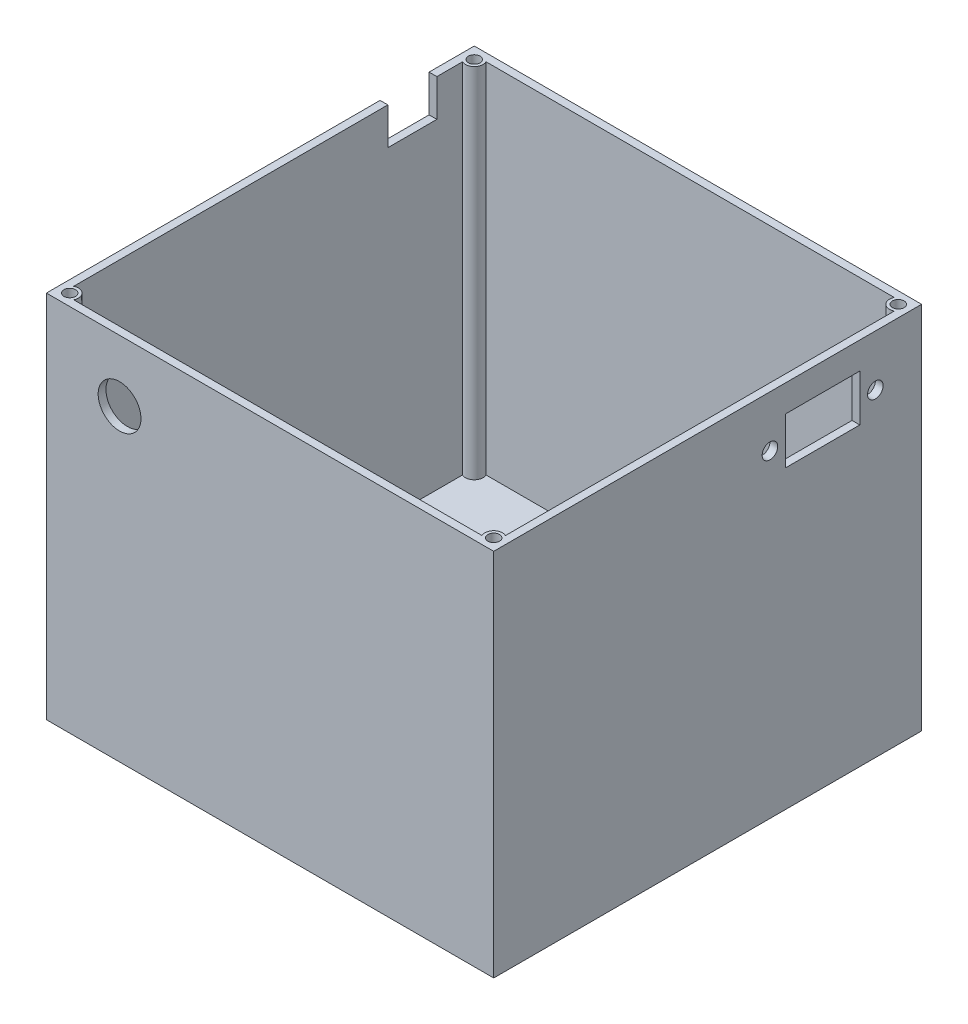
SolidWorks part; units mm, degrees
ref_plane "Front Plane" through (0, 0, 0) normal (0, 0, 1) x (1, 0, 0)
ref_plane "Top Plane" through (0, 0, 0) normal (0, 1, 0) x (1, 0, 0)
ref_plane "Right Plane" through (0, 0, 0) normal (1, 0, 0) x (0, 0, -1)
sketch "Sketch1" plane through (0, 0, 0) normal (0, 1, 0) x (1, 0, 0)
  line L0 (175.3003, 32.8635) -> (280.2692, 32.8635)
  line L1 (170.2848, 34.8635) -> (285.2848, 34.8635)
  line L2 (170.2848, 34.8635) -> (170.2848, -75.1365)
  line L3 (170.2848, -75.1365) -> (285.2848, -75.1365)
  line L4 (285.2848, 34.8635) -> (285.2848, -75.1365)
  line L5 (172.2848, 29.848) -> (172.2848, -70.1209)
  line L6 (175.3003, -73.1365) -> (280.2692, -73.1365)
  line L7 (283.2848, -70.1209) -> (283.2848, 29.848)
  circle A8 centre (173.2848, 31.8635) radius 2.25
  circle A9 centre (282.2848, 31.8635) radius 2.25
  circle A10 centre (173.2848, -72.1365) radius 2.25
  circle A11 centre (282.2848, -72.1365) radius 2.25
  circle A12 centre (173.2848, 31.8635) radius 1.5
  circle A13 centre (173.2848, -72.1365) radius 1.5
  circle A14 centre (282.2848, -72.1365) radius 1.5
  circle A15 centre (282.2848, 31.8635) radius 1.5
  dimension "D3" = 4.5
  dimension "D4" = 4.5
  dimension "D5" = 4.5
  dimension "D6" = 4.5
  dimension "D7" = 3
  dimension "D8" = 3
  dimension "D9" = 3
  dimension "D10" = 3
  dimension "D11" = 3
  dimension "D12" = 3
  dimension "D13" = 3
  dimension "D14" = 3
  dimension "D15" = 3
  dimension "D20" = 2
  dimension "D21" = 2
  dimension "D16" = 3
  dimension "D17" = 3
  dimension "D22" = 3
  dimension "D1" = 115
  dimension "D2" = 110
  dimension "D18" = 2
  dimension "D19" = 2
extrude "Boss-Extrude6" add sketch "Sketch1" along normal blind 92 contours L4 L1 L2 L3 A11 L6 A10 L5 A8 L0 A9 L7 | A13 | A12 | A15 | A14
sketch "Sketch2" plane through (0, 0, 0) normal (0, -1, 0) x (1, 0, 0)
  line L1 (170.2848, 75.1365) -> (285.2848, 75.1365)
  line L2 (170.2848, 75.1365) -> (170.2848, -34.8635)
  line L3 (170.2848, -34.8635) -> (285.2848, -34.8635)
  line L4 (285.2848, 75.1365) -> (285.2848, -34.8635)
extrude "Boss-Extrude7" add sketch "Sketch2" along normal blind 3
sketch "Sketch3" plane through (0, -3, 0) normal (0, -1, 0) x (1, 0, 0)
  line L0 (285.2848, 75.1365) -> (170.2848, 75.1365) construction
  line L1 (170.2848, 75.1365) -> (170.2848, -34.8635) construction
  line L2 (285.2848, -34.8635) -> (285.2848, 75.1365) construction
  line L3 (170.2848, -34.8635) -> (285.2848, -34.8635) construction
  circle A0 centre (173.2848, 72.1365) radius 1.5
  circle A1 centre (282.2848, 72.1365) radius 1.5
  circle A2 centre (173.2856, -31.8635) radius 1.5
  circle A3 centre (282.2848, -31.8635) radius 1.5
  dimension "D1" = 3
  dimension "D2" = 3
  dimension "D3" = 3
  dimension "D4" = 3
  dimension "D5" = 3
  dimension "D6" = 3
  dimension "D7" = 3
  dimension "D8" = 3.0008
  dimension "D9" = 3
  dimension "D10" = 3
  dimension "D11" = 3
  dimension "D12" = 3
extrude "Boss-Extrude8" add sketch "Sketch3" against normal blind 35
sketch "Sketch4" plane through (0, 0, 75.1365) normal (0, 0, 1) x (1, 0, 0)
  line L0 (0.1862, -29.345) -> (0.1862, 29.345) construction
  line L1 (-9.55, 4.0911) -> (9.55, 4.0911)
  line L2 (-9.55, 4.0911) -> (-9.55, -7.9089)
  line L3 (-9.55, -7.9089) -> (9.55, -7.9089)
  line L4 (9.55, 4.0911) -> (9.55, -7.9089)
  circle A0 centre (189.0931, 76.1835) radius 5.5
  circle A1 centre (14.55, -2.0854) radius 1.75
  circle A2 centre (-14.55, -2.0854) radius 1.75
  dimension "D1" = 11
  dimension "D4" = 3.5
  dimension "D5" = 3.5
  dimension "D2" = 12
  dimension "D3" = 19.1
  dimension "D6" = 5
  dimension "D7" = 5
extrude "Cut-Extrude1" cut sketch "Sketch4" against normal blind 10
sketch "Sketch7" plane through (170.2848, 0, 0) normal (-1, 0, 0) x (0, 0, 1)
  line L0 (-34.8635, 85.6991) -> (-14.1802, 85.6991) construction
  line L1 (-34.8635, 92) -> (-34.8635, -3) construction
  line L3 (-7.2659, 92.0603) -> (-21.0945, 92.0603)
  line L4 (-7.2659, 92.0603) -> (-7.2659, 79.3379)
  line L5 (-7.2659, 79.3379) -> (-21.0945, 79.3379)
  line L6 (-21.0945, 92.0603) -> (-21.0945, 79.3379)
  line L7 (-7.2659, 92.0603) -> (-21.0945, 79.3379) construction
  line L8 (-7.2659, 79.3379) -> (-21.0945, 92.0603) construction
sketch "Sketch8" plane through (0, -3, 0) normal (0, -1, 0) x (1, 0, 0)
  line L1 (187.762, 57.4809) -> (267.762, 57.4809)
  line L2 (187.762, 57.4809) -> (187.762, -17.5191)
  line L3 (187.762, -17.5191) -> (267.762, -17.5191)
  line L4 (267.762, 57.4809) -> (267.762, -17.5191)
  line L28 (227.762, 57.4809) -> (227.762, 57.4961) construction
  line L29 (224.762, -17.4673) -> (230.762, -17.4673)
  line L30 (224.762, -17.4673) -> (224.762, 57.4885)
  line L31 (224.762, 57.4885) -> (230.762, 57.4885)
  line L32 (230.762, -17.4673) -> (230.762, 57.4885)
  line L33 (210.2172, 57.5219) -> (216.432, 57.5219)
  line L34 (239.092, 57.5219) -> (245.092, 57.5219)
  line L35 (239.092, 57.5219) -> (239.092, -17.2686)
  line L36 (239.092, -17.2686) -> (245.092, -17.2686)
  line L37 (245.092, 57.5219) -> (245.092, -17.2686)
  line L38 (210.2172, 57.5219) -> (210.2172, -17.2686)
  line L39 (210.2172, -17.2686) -> (216.432, -17.2686)
  line L40 (216.432, 57.5219) -> (216.432, -17.2686)
  line L41 (253.422, 57.5219) -> (259.422, 57.5219)
  line L42 (253.422, 57.5219) -> (253.422, -17.2686)
  line L43 (253.422, -17.2686) -> (259.422, -17.2686)
  line L44 (259.422, 57.5219) -> (259.422, -17.2686)
  line L45 (196.092, 57.5219) -> (202.092, 57.5219)
  line L46 (196.092, 57.5219) -> (196.092, -17.2686)
  line L47 (196.092, -17.2686) -> (202.092, -17.2686)
  line L48 (202.092, 57.5219) -> (202.092, -17.2686)
  line L49 (187.6554, 35.2102) -> (267.7678, 35.2102)
  line L50 (187.7931, 21.7102) -> (267.6301, 21.7102)
  line L51 (187.7931, 21.7102) -> (187.7931, 15.7102)
  line L52 (187.7931, 15.7102) -> (267.6301, 15.7102)
  line L53 (267.6301, 21.7102) -> (267.6301, 15.7102)
  line L54 (187.6554, 35.2102) -> (187.6554, 29.2102)
  line L55 (187.6554, 29.2102) -> (267.7678, 29.2102)
  line L56 (267.7678, 35.2102) -> (267.7678, 29.2102)
  line L57 (-34.412, 3) -> (34.412, 3)
  line L58 (-34.412, 3) -> (-34.412, -3)
  line L59 (-34.412, -3) -> (34.412, -3)
  line L60 (34.412, 3) -> (34.412, -3)
  line L61 (187.9307, 48.7102) -> (267.6301, 48.7102)
  line L62 (187.9307, 48.7102) -> (187.9307, 42.7102)
  line L63 (187.9307, 42.7102) -> (267.6301, 42.7102)
  line L64 (267.6301, 48.7102) -> (267.6301, 42.7102)
  line L65 (187.6554, 8.2102) -> (267.6301, 8.2102)
  line L66 (187.6554, 8.2102) -> (187.6554, 2.2102)
  line L67 (187.6554, 2.2102) -> (267.6301, 2.2102)
  line L68 (267.6301, 8.2102) -> (267.6301, 2.2102)
  line L69 (187.6554, -5.2898) -> (267.6301, -5.2898)
  line L70 (187.6554, -5.2898) -> (187.6554, -11.2898)
  line L71 (187.6554, -11.2898) -> (267.6301, -11.2898)
  line L72 (267.6301, -5.2898) -> (267.6301, -11.2898)
  point P10 (227.762, 57.4885)
  dimension "D1" = 80
  dimension "D2" = 75
  dimension "D3" = 6
  dimension "D4" = 6
  dimension "D5" = 8.33
  dimension "D6" = 8.33
  dimension "D7" = 8.33
  dimension "D8" = 8.33
  dimension "D9" = 6
  dimension "D10" = 7.5
  dimension "D11" = 7.5
  dimension "D12" = 7.5
  dimension "D13" = 6
  dimension "D14" = 7.5
extrude "Cut-Extrude5" cut sketch "Sketch8" against normal blind 10 contours L55 L40 L50 L30 | L55 L32 L50 L35 | L63 L32 L49 L35 | L63 L40 L49 L30 | L40 L61 L30 L1 | L32 L61 L35 L1 | L37 L61 L42 L1 | L61 L64 L63 L44 L49 L4 L1 | L63 L37 L49 L42 | L55 L37 L50 L42 | L69 L72 L71 L44 L43 L42 L37 L36 L35 L32 L29 L30 L40 L39 L38 L48 L47 L46 L2 L3 L4 L55 L50 L53 L52 L65 L68 L67 | L37 L65 L42 L52 | L32 L65 L35 L52 | L40 L65 L30 L52 | L48 L65 L38 L52 | L48 L69 L38 L67 | L40 L69 L30 L67 | L32 L69 L35 L67 | L37 L69 L42 L67 | L2 L69 L46 L67 | L2 L65 L46 L52 L51 L50 L55 | L55 L48 L50 L38 | L63 L48 L49 L38 | L63 L62 L61 L46 L1 L2 L49 | L48 L61 L38 L1
sketch "Sketch10" plane through (285.2848, 0, 0) normal (1, 0, 0) x (0, 0, -1)
  line L0 (-0.1275, 85.0769) -> (18.9725, 85.0769)
  line L1 (-0.1275, 85.0769) -> (-0.1275, 73.0769)
  line L2 (-0.1275, 73.0769) -> (18.9725, 73.0769)
  line L3 (18.9725, 85.0769) -> (18.9725, 73.0769)
  circle A0 centre (22.9725, 78.8556) radius 2
  circle A1 centre (-4.1275, 78.8556) radius 2
  dimension "D3" = 4
  dimension "D4" = 4
  dimension "D1" = 12
  dimension "D2" = 19.1
  dimension "D5" = 4
  dimension "D6" = 4
sketch "Sketch11" plane through (170.2848, 0, 0) normal (-1, 0, 0) x (0, 0, 1)
  line L0 (-34.8635, 92) -> (75.1365, 92) construction
  line L1 (-23.2472, 92) -> (-10.6506, 92)
  line L2 (-23.2472, 92) -> (-23.2472, 82.4736)
  line L3 (-23.2472, 82.4736) -> (-10.6506, 82.4736)
  line L4 (-10.6506, 92) -> (-10.6506, 82.4736)
extrude "Cut-Extrude6" cut sketch "Sketch11" against normal blind 10
extrude "Cut-Extrude7" cut sketch "Sketch10" against normal blind 10
extrude "Cut-Extrude4" cut sketch "Sketch7" against normal blind 10
